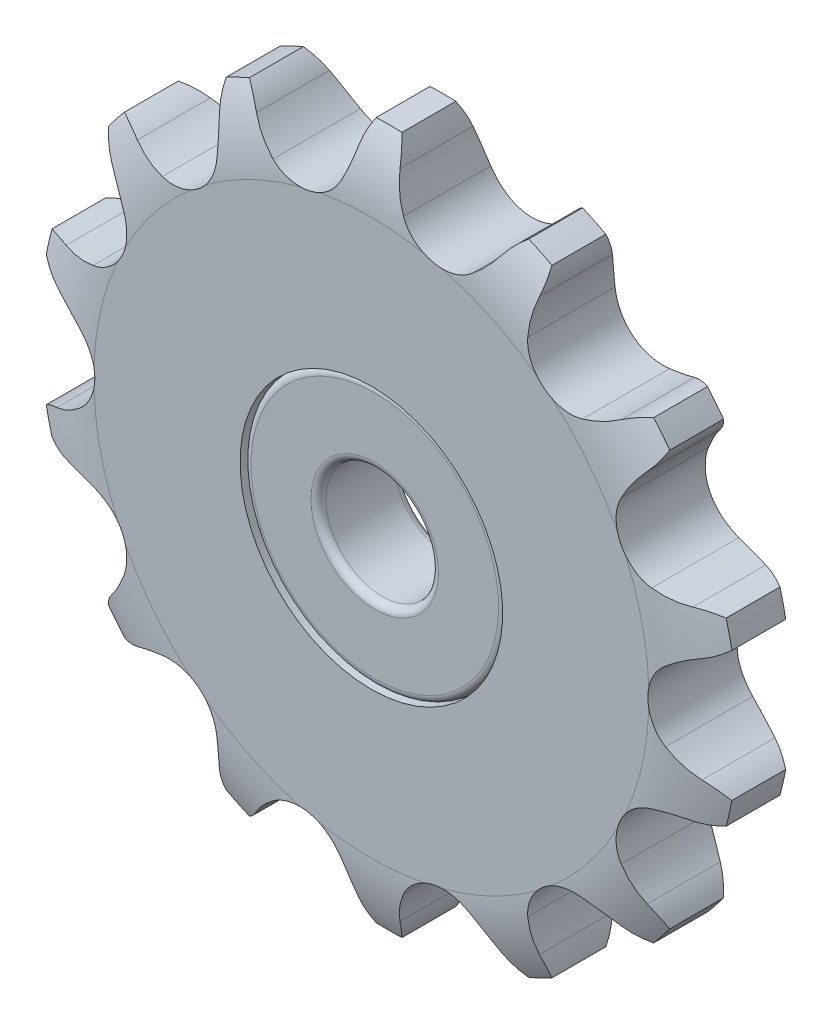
SolidWorks part; units mm, degrees
other "Imported1"
ref_plane "Front" through (0, 0, 0) normal (0, 0, 1) x (1, 0, 0)
ref_plane "Top" through (0, 0, 0) normal (0, 1, 0) x (1, 0, 0)
ref_plane "Right" through (0, 0, 0) normal (1, 0, 0) x (0, 0, -1)
imported_body "ｲﾝﾎﾟｰﾄ1"
sketch "ｽｹｯﾁ1" plane through (0, 0, 0) normal (0, 0, 1) x (1, 0, 0)
  circle A0 centre (0, 0) radius 62.7311
  circle A1 centre (0, 0) radius 46.5
extrude "ｶｯﾄ - 押し出し1" cut sketch "ｽｹｯﾁ1" against normal through all both and the other way through all
